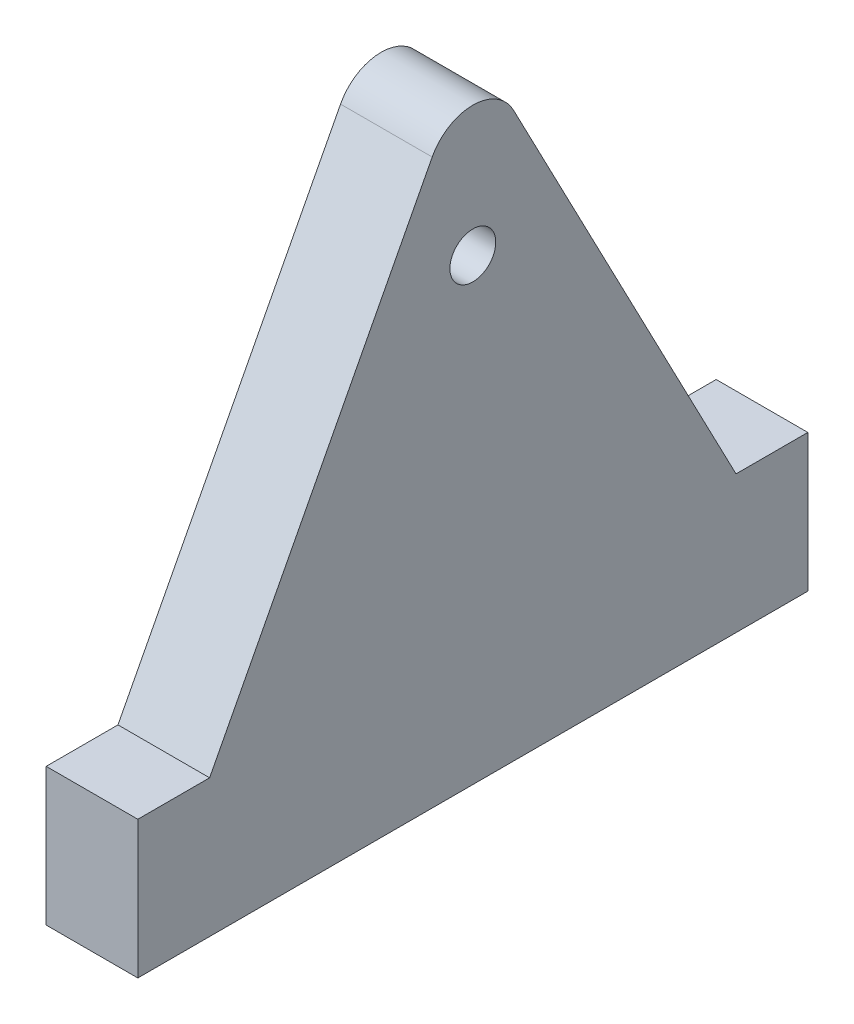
SolidWorks part; units mm, degrees
ref_plane "Front Plane" through (0, 0, 0) normal (0, 0, 1) x (1, 0, 0)
ref_plane "Top Plane" through (0, 0, 0) normal (0, 1, 0) x (1, 0, 0)
ref_plane "Right Plane" through (0, 0, 0) normal (1, 0, 0) x (0, 0, -1)
sketch "Sketch1" plane through (0, 0, 0) normal (1, 0, 0) x (0, 0, -1)
  line L0 (-8.8644, 53.023) -> (-73.0996, -70)
  line L3 (-73.0996, -70) -> (73.0996, -70)
  line L6 (-73.0996, -70) -> (24.3665, 23.3333) construction
  line L7 (8.8644, 53.023) -> (73.0996, -70)
  line L10 (-24.3665, 23.3333) -> (73.0996, -70) construction
  arc A1 (8.8644, 53.023) -> (-8.8644, 53.023) centre (0, 48.3945) ccw
  point P1 (0, 0)
  point P7 (0, -70)
  point P12 (0, 70)
  dimension "D4" = 10
  dimension "D1" = 140
extrude "Boss-Extrude1" add sketch "Sketch1" along normal blind 20 contours L0 L3 L7 A1
sketch "Sketch2" plane through (20, 0, 0) normal (1, 0, 0) x (0, 0, -1)
  line L0 (-73.0996, -70) -> (73.0996, -70) construction
  circle A0 centre (0, 30) radius 5
  dimension "D1" = 10
  dimension "D2" = 100
extrude "Cut-Extrude2" cut sketch "Sketch2" against normal through all both and the other way through all
sketch "Sketch3" plane through (0, -70, 0) normal (0, -1, 0) x (1, 0, 0)
  line L1 (0, 73.0996) -> (20, 73.0996)
  line L2 (0, 73.0996) -> (0, -73.0996)
  line L3 (0, -73.0996) -> (20, -73.0996)
  line L4 (20, 73.0996) -> (20, -73.0996)
extrude "Boss-Extrude2" add sketch "Sketch3" against normal blind 30
